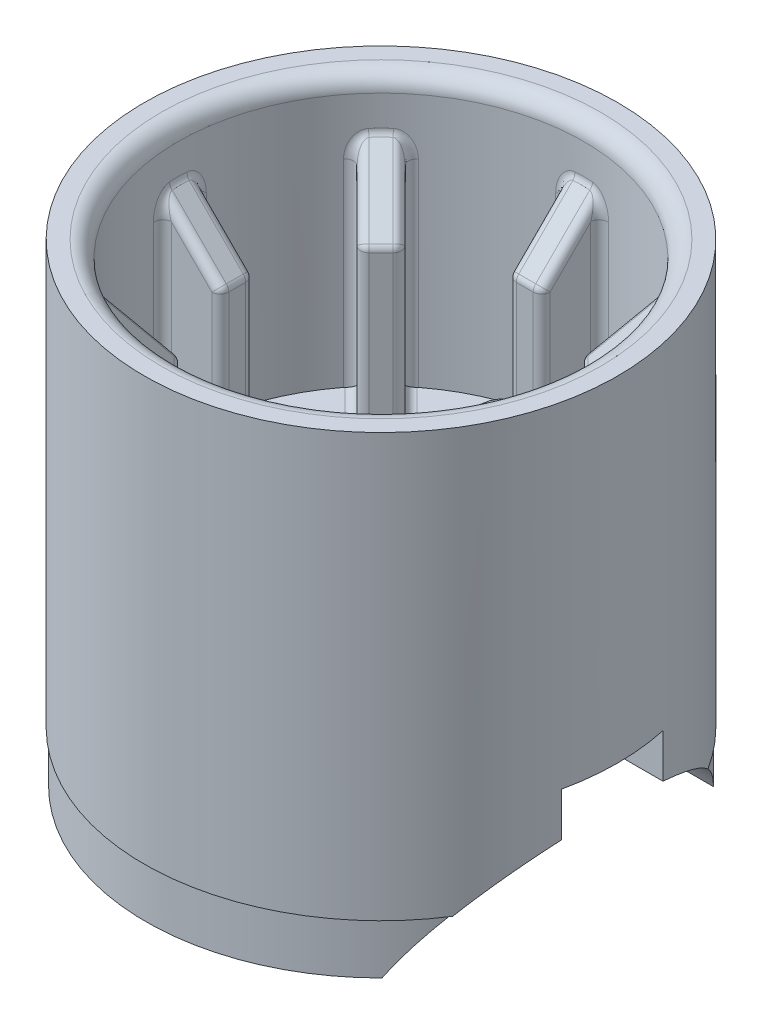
SolidWorks part; units mm, degrees
ref_plane "Face" through (0, 0, 0) normal (0, 0, 1) x (1, 0, 0)
ref_plane "Dessus" through (0, 0, 0) normal (0, 1, 0) x (1, 0, 0)
ref_plane "Droite" through (0, 0, 0) normal (1, 0, 0) x (0, 0, -1)
sketch "Esquisse1" plane through (0, 0, 0) normal (0, 0, 1) x (1, 0, 0)
  line L0 (0, 14.8075) -> (0, 67.6347) construction
  line L1 (13.9, 60) -> (13.9, 57)
  line L2 (13.9, 60) -> (14, 60)
  line L3 (12, 85) -> (14, 85)
  line L4 (0, -50) -> (0, 50) construction
  line L5 (0, 57) -> (13.9, 57)
  line L6 (14, 85) -> (14, 60)
  line L7 (0, 57) -> (0, 69)
  line L8 (0, 69) -> (12, 69)
  line L9 (12, 69) -> (12, 85)
  dimension "D1" = 2
  dimension "D2" = 12
  dimension "D3" = 28
  dimension "D4" = 0.1
revolve "Base-Révolution" add sketch "Esquisse1" angle 360 about L0
fillet "Congé1" radius 1
sketch "Esquisse2" plane through (0, 0, 0) normal (0, 0, 1) x (1, 0, 0)
  line L0 (-8.5, 78.5) -> (-8.5, 69)
  line L3 (-8.5, 69) -> (-12.2, 69)
  line L4 (-8.5, 78.5) -> (-12.2, 82.2)
  line L5 (12, 69) -> (-12, 69) construction
  line L6 (-12.2, 69) -> (-12.2, 82.2)
  line L8 (0, 14.8075) -> (0, 67.6347) construction
  line L9 (-12, 84) -> (-12, 69) construction
  dimension "D1" = 8.5
  dimension "D2" = 45
  dimension "D3" = 0.2
extrude "Boss.-Extru.1" add sketch "Esquisse2" along normal mid plane 2
fillet "Congé2" radius 0.5
pattern_circular "Répétition circulaire1" count 8 every 45 about axis through (0, 14.8075, 0) along (0, 1, 0)
sketch "Esquisse3" plane through (0, 0, 0) normal (1, 0, 0) x (0, 0, -1)
  line L0 (0, -2.6301) -> (0, 26.2601) construction
  line L1 (-14, 57) -> (14, 57) construction
  line L2 (0, 52) -> (0, 102) construction
  line L4 (3, 65.1792) -> (-3, 65.1792)
  line L5 (3, 62.583) -> (3, 65.1792)
  line L7 (-3, 62.583) -> (-3, 65.1792)
  arc A1 (-3, 62.583) -> (3, 62.583) centre (0, 52) ccw
  dimension "D1" = 11
  dimension "D2" = 5
extrude "Enlèv. mat.-Extru.1" cut sketch "Esquisse3" against normal mid plane 50
sketch "Esquisse4" plane through (0, 0, 0) normal (1, 0, 0) x (0, 0, -1)
  line L0 (0, 14.8075) -> (0, 67.6347) construction
  line L1 (-10, 57.3691) -> (-10, 73.7872) construction
  line L3 (0, 52) -> (-10, 65.1244) construction
  line L4 (-10, 59.1244) -> (-10, 71.1244)
  arc A0 (-10, 59.1244) -> (-10, 71.1244) centre (-10, 65.1244) ccw
  dimension "D2" = 12
  dimension "D1" = 10
  dimension "D3" = 16.5
revolve "Révolution1" add sketch "Esquisse4" angle 180 about L1
mirror "Symétrie1" about plane through (0, 0, 0) normal (0, 0, 1)
